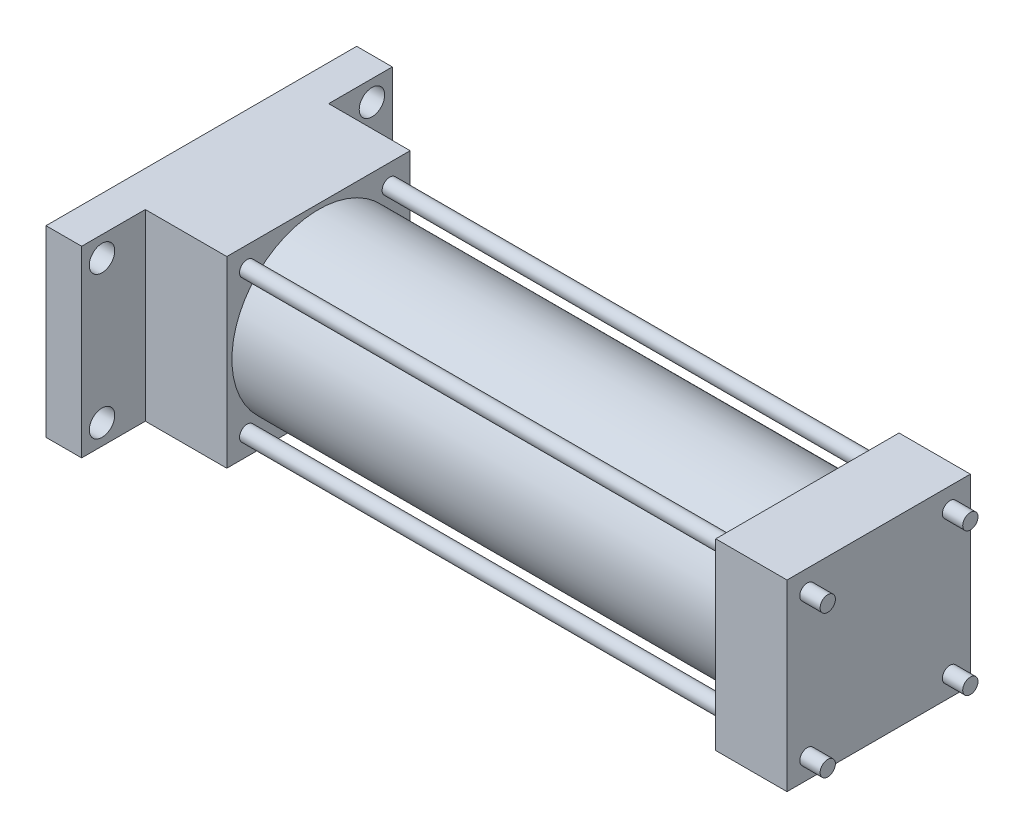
SolidWorks part; units mm, degrees
ref_plane "front" through (0, 0, 0) normal (0, 0, 1) x (1, 0, 0)
ref_plane "top" through (0, 0, 0) normal (0, 1, 0) x (1, 0, 0)
ref_plane "side" through (0, 0, 0) normal (1, 0, 0) x (0, 0, -1)
sketch "Sketch1" plane through (0, 0, 0) normal (1, 0, 0) x (0, 0, -1)
  line L0 (-57.15, 57.15) -> (57.15, 57.15)
  line L1 (-57.15, 57.15) -> (-57.15, -57.15)
  line L2 (57.15, -57.15) -> (-57.15, -57.15)
  line L3 (57.15, -57.15) -> (57.15, 57.15)
  line L4 (0, 57.15) -> (0, 0) construction
  line L5 (57.15, 0) -> (0, 0) construction
  dimension "D1" = 114.3
extrude "Base-Extrude" add sketch "Sketch1" against normal blind 44.45
sketch "Sketch2" plane through (-44.45, 0, 0) normal (-1, 0, 0) x (0, 0, 1)
  circle A0 centre (0, 0) radius 53.975
  dimension "D1" = 107.95
extrude "Boss-Extrude1" add sketch "Sketch2" along normal blind 304.8
sketch "Sketch3" plane through (-349.25, 0, 0) normal (-1, 0, 0) x (0, 0, 1)
  line L4 (57.15, -57.15) -> (57.15, 57.15)
  line L5 (57.15, 57.15) -> (-57.15, 57.15)
  line L6 (-57.15, 57.15) -> (-57.15, -57.15)
  line L7 (-57.15, -57.15) -> (57.15, -57.15)
  line L8 (57.15, -57.15) -> (57.15, 57.15)
  line L9 (57.15, 57.15) -> (-57.15, 57.15)
  line L10 (-57.15, 57.15) -> (-57.15, -57.15)
  line L11 (-57.15, -57.15) -> (57.15, -57.15)
  dimension "D1" = 0
extrude "Boss-Extrude2" add sketch "Sketch3" along normal blind 73.025
sketch "Sketch4" plane through (-422.275, 0, 0) normal (-1, 0, 0) x (0, 0, 1)
  circle A0 centre (0, 0) radius 25.4
  dimension "D1" = 50.8
extrude "Boss-Extrude3" add sketch "Sketch4" along normal blind 25.4
sketch "Sketch5" plane through (-447.675, 0, 0) normal (-1, 0, 0) x (0, 0, 1)
  circle A0 centre (0, 0) radius 17.4625
  dimension "D1" = 34.925
extrude "Cut-Extrude1" cut sketch "Sketch5" against normal up to surface (403.225 mm away)
sketch "Sketch6" plane through (-349.25, 0, 0) normal (1, 0, 0) x (0, 0, -1)
  line L0 (-57.15, 57.15) -> (57.15, 57.15) construction
  line L1 (-57.15, -57.15) -> (-57.15, 57.15) construction
  line L2 (0, 57.15) -> (0, 0) construction
  line L3 (-57.15, 0) -> (0, 0) construction
  circle A0 centre (-44.45, 44.45) radius 4.7625
  circle A1 centre (44.45, 44.45) radius 4.7625
  circle A2 centre (44.45, -44.45) radius 4.7625
  circle A3 centre (-44.45, -44.45) radius 4.7625
  dimension "D2" = 9.525
  dimension "D1" = 12.7
  dimension "D3" = 12.7
extrude "Boss-Extrude4" add sketch "Sketch6" along normal offset from surface (361.95 mm away) 12.7
sketch "Sketch7" plane through (-422.275, 0, 0) normal (-1, 0, 0) x (0, 0, 1)
  line L0 (-96.8375, -57.15) -> (96.8375, -57.15)
  line L1 (-96.8375, -57.15) -> (-96.8375, 57.15)
  line L2 (96.8375, 57.15) -> (-96.8375, 57.15)
  line L3 (96.8375, 57.15) -> (96.8375, -57.15)
  line L4 (57.15, 57.15) -> (-57.15, 57.15) construction
  line L5 (-57.15, -57.15) -> (57.15, -57.15) construction
  line L7 (0, 57.15) -> (0, 0) construction
  line L12 (-84.1375, 0) -> (0, 0) construction
  dimension "D1" = 193.675
extrude "Boss-Extrude5" add sketch "Sketch7" against normal blind 22.225
sketch "Sketch8" plane through (-422.275, 0, 0) normal (-1, 0, 0) x (0, 0, 1)
  line L0 (-96.8375, -57.15) -> (96.8375, -57.15) construction
  line L1 (96.8375, 57.15) -> (96.8375, -57.15) construction
  circle A0 centre (84.1375, -44.45) radius 7.9375
  dimension "D1" = 15.875
  dimension "D2" = 12.7
  dimension "D3" = 12.7
extrude "Cut-Extrude2" cut sketch "Sketch8" against normal up to next
pattern_linear "LPattern2" count 2 spacing 168.275 along (0, 0, -1) count 2 spacing 88.9 along (0, 1, 0) of "Cut-Extrude2"
